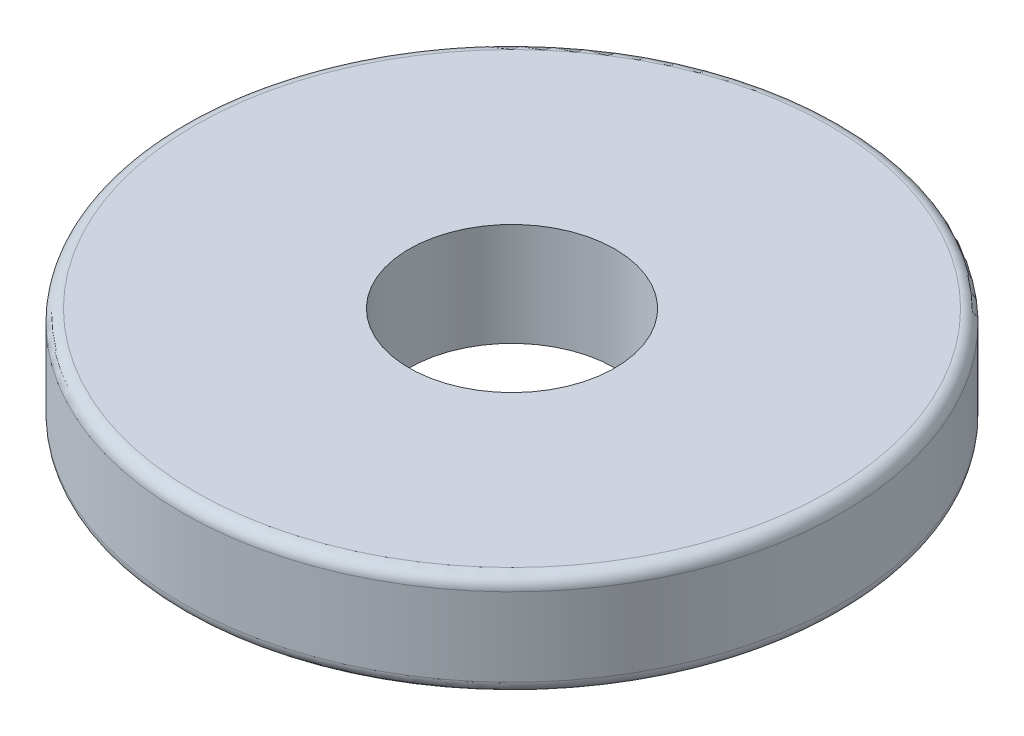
SolidWorks part; units mm, degrees
ref_plane "Plan de face" through (0, 0, 0) normal (0, 0, 1) x (1, 0, 0)
ref_plane "Plan de dessus" through (0, 0, 0) normal (0, 1, 0) x (1, 0, 0)
ref_plane "Plan de droite" through (0, 0, 0) normal (1, 0, 0) x (0, 0, -1)
sketch "Esquisse1" plane through (0, 0, 0) normal (0, 0, 1) x (1, 0, 0)
  line L0 (0, 0) -> (0, 36.3981) construction
  line L1 (2.5, 1) -> (8, 1)
  line L2 (2.5, 1) -> (2.5, 3.5)
  line L3 (2.5, 3.5) -> (8, 3.5)
  line L4 (8, 1) -> (8, 3.5)
  dimension "D1" = 5
  dimension "D2" = 16
  dimension "D3" = 2.5
  dimension "D4" = 1
revolve "Révolution1" add sketch "Esquisse1" angle 360 about L0
fillet "Congé1" radius 0.3 2 edges at (0, 1, -8) (0, 3.5, -8)
